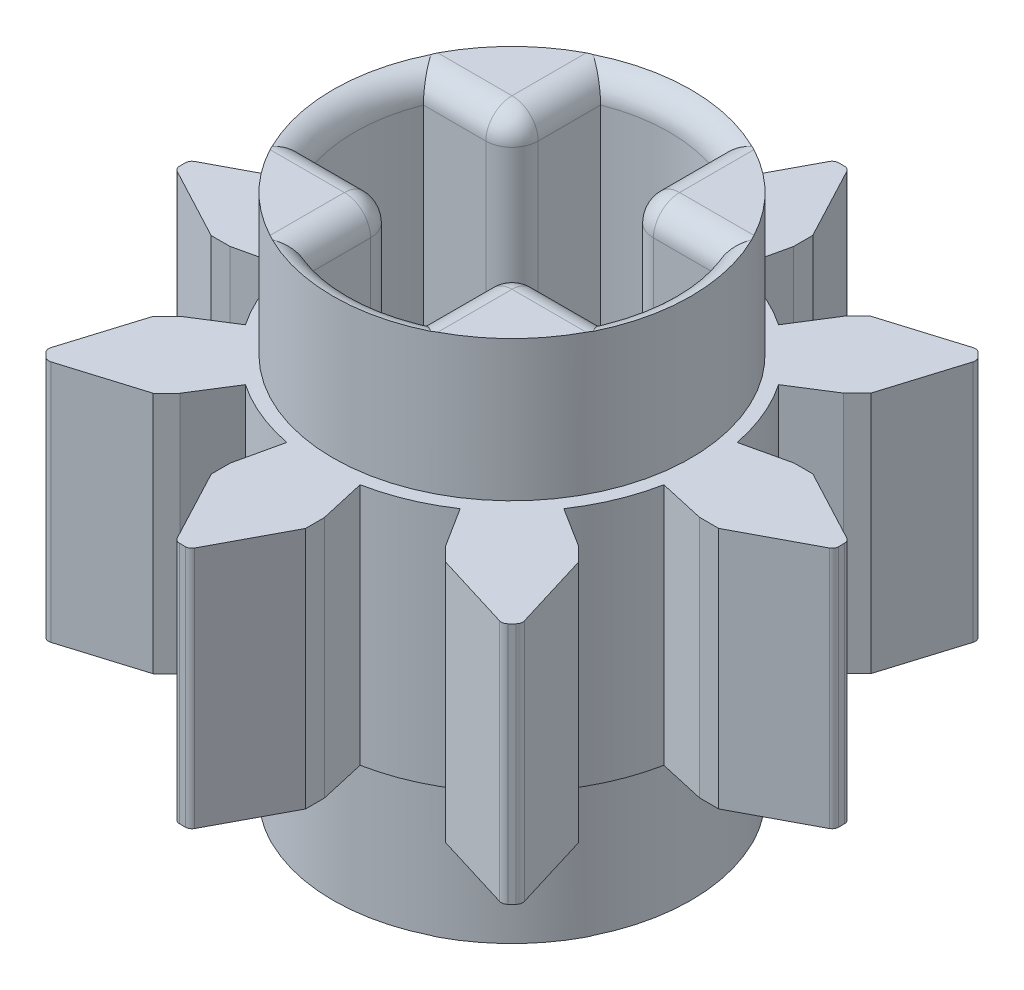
SolidWorks part; units mm, degrees
ref_plane "Front Plane" through (0, 0, 0) normal (0, 0, 1) x (1, 0, 0)
ref_plane "Top Plane" through (0, 0, 0) normal (0, 1, 0) x (1, 0, 0)
ref_plane "Right Plane" through (0, 0, 0) normal (1, 0, 0) x (0, 0, -1)
ref_plane "Plane1" through (0, 1.855, 0) normal (0, 1, 0) x (1, 0, 0)
sketch "Sketch1" plane through (0, 1.855, 0) normal (0, 1, 0) x (1, 0, 0)
  line L0 (-5.0277, -0.2195) -> (-3.8881, -0.862)
  line L1 (-3.8881, -0.862) -> (-2.8786, -0.5595)
  line L2 (-2.4312, -1.6398) -> (-3.3588, -2.1398)
  line L3 (-3.3588, -2.1398) -> (-3.7103, -3.3999)
  line L4 (-3.3999, -3.7103) -> (-2.1398, -3.3588)
  line L5 (-2.1398, -3.3588) -> (-1.6398, -2.4312)
  line L6 (-0.5595, -2.8786) -> (-0.862, -3.8881)
  line L7 (-0.862, -3.8881) -> (-0.2195, -5.0277)
  line L8 (0.2195, -5.0277) -> (0.862, -3.8881)
  line L9 (0.862, -3.8881) -> (0.5595, -2.8786)
  line L10 (1.6398, -2.4312) -> (2.1398, -3.3588)
  line L11 (2.1398, -3.3588) -> (3.3999, -3.7103)
  line L12 (3.7103, -3.3999) -> (3.3588, -2.1398)
  line L13 (3.3588, -2.1398) -> (2.4312, -1.6398)
  line L14 (2.8786, -0.5595) -> (3.8881, -0.862)
  line L15 (3.8881, -0.862) -> (5.0277, -0.2195)
  line L16 (5.0277, 0.2195) -> (3.8881, 0.862)
  line L17 (3.8881, 0.862) -> (2.8786, 0.5595)
  line L18 (2.4312, 1.6398) -> (3.3588, 2.1398)
  line L19 (3.3588, 2.1398) -> (3.7103, 3.3999)
  line L20 (3.3999, 3.7103) -> (2.1398, 3.3588)
  line L21 (2.1398, 3.3588) -> (1.6398, 2.4312)
  line L22 (0.5595, 2.8786) -> (0.862, 3.8881)
  line L23 (0.862, 3.8881) -> (0.2195, 5.0277)
  line L24 (-0.2195, 5.0277) -> (-0.862, 3.8881)
  line L25 (-0.862, 3.8881) -> (-0.5595, 2.8786)
  line L26 (-1.6398, 2.4312) -> (-2.1398, 3.3588)
  line L27 (-2.1398, 3.3588) -> (-3.3999, 3.7103)
  line L28 (-3.7103, 3.3999) -> (-3.3588, 2.1398)
  line L29 (-3.3588, 2.1398) -> (-2.4312, 1.6398)
  line L30 (-2.8786, 0.5595) -> (-3.8881, 0.862)
  line L31 (-3.8881, 0.862) -> (-5.0277, 0.2195)
  arc A0 (-5.0277, 0.2195) -> (-5.0277, -0.2195) centre (0, 0) ccw
  arc A1 (-2.8786, -0.5595) -> (-2.4312, -1.6398) centre (0, 0) ccw
  arc A2 (-3.7103, -3.3999) -> (-3.3999, -3.7103) centre (0, 0) ccw
  arc A3 (-1.6398, -2.4312) -> (-0.5595, -2.8786) centre (0, 0) ccw
  arc A4 (-0.2195, -5.0277) -> (0.2195, -5.0277) centre (0, 0) ccw
  arc A5 (0.5595, -2.8786) -> (1.6398, -2.4312) centre (0, 0) ccw
  arc A6 (3.3999, -3.7103) -> (3.7103, -3.3999) centre (0, 0) ccw
  arc A7 (2.4312, -1.6398) -> (2.8786, -0.5595) centre (0, 0) ccw
  arc A8 (5.0277, -0.2195) -> (5.0277, 0.2195) centre (0, 0) ccw
  arc A9 (2.8786, 0.5595) -> (2.4312, 1.6398) centre (0, 0) ccw
  arc A10 (3.7103, 3.3999) -> (3.3999, 3.7103) centre (0, 0) ccw
  arc A11 (1.6398, 2.4312) -> (0.5595, 2.8786) centre (0, 0) ccw
  arc A12 (0.2195, 5.0277) -> (-0.2195, 5.0277) centre (0, 0) ccw
  arc A13 (-0.5595, 2.8786) -> (-1.6398, 2.4312) centre (0, 0) ccw
  arc A14 (-3.3999, 3.7103) -> (-3.7103, 3.3999) centre (0, 0) ccw
  arc A15 (-2.4312, 1.6398) -> (-2.8786, 0.5595) centre (0, 0) ccw
extrude "Boss-Extrude1" add sketch "Sketch1" against normal blind 3.71
sketch "Sketch2" plane through (0, 1.855, 0) normal (0, 1, 0) x (-1, 0, 0)
  circle A0 centre (0, 0) radius 2.7325
extrude "Boss-Extrude2" add sketch "Sketch2" along normal blind 2.1775
sketch "Sketch3" plane through (0, -1.855, 0) normal (0, -1, 0) x (1, 0, 0)
  circle A0 centre (0, 0) radius 2.7325
extrude "Boss-Extrude3" add sketch "Sketch3" along normal blind 2.1775
hole_wizard "M4 Clearance Hole1" positions "Sketch5" profile "Sketch4" hole size "M4" standard "ANSI Metric"
sketch "Sketch5" plane through (0, -4.0325, 0) normal (0, -1, 0) x (-1, 0, 0)
  point P0 (0, 0)
sketch "Sketch4" plane through (0, -4.0325, 0) normal (1, 0, 0) x (0, 0, -1)
  line L0 (0, 0) -> (0, 8.065)
  line L1 (0, 8.065) -> (2.39, 8.065)
  line L2 (2.39, 8.065) -> (2.39, 0)
  line L5 (2.39, 0) -> (0, 0)
  line L11 (0, -6.35) -> (0, 107.95) construction
  dimension "Thru Hole Dia." = 4.78
  dimension "Thru Hole Depth" = 8.065
ref_plane "Plane2" through (0, -3.9, 0) normal (0, -1, 0) x (1, 0, 0)
sketch "Sketch6" plane through (0, -3.9, 0) normal (0, -1, 0) x (1, 0, 0)
  line L0 (0.875, 2.2241) -> (0.875, 0.875)
  line L1 (0.875, 0.875) -> (2.2241, 0.875)
  arc A0 (2.2241, 0.875) -> (0.875, 2.2241) centre (0, 0) ccw
extrude "Boss-Extrude4" add sketch "Sketch6" against normal blind 7.8
ref_plane "Plane3" through (0, 3.9, 0) normal (0, 1, 0) x (1, 0, 0)
sketch "Sketch7" plane through (0, 3.9, 0) normal (0, 1, 0) x (1, 0, 0)
  line L0 (-0.875, -0.875) -> (-2.2241, -0.875)
  line L1 (-0.875, -2.2241) -> (-0.875, -0.875)
  arc A0 (-2.2241, -0.875) -> (-0.875, -2.2241) centre (0, 0) ccw
extrude "Boss-Extrude5" add sketch "Sketch7" against normal blind 7.8
sketch "Sketch8" plane through (0, -3.9, 0) normal (0, -1, 0) x (1, 0, 0)
  line L0 (2.2241, -0.875) -> (0.875, -0.875)
  line L1 (0.875, -0.875) -> (0.875, -2.2241)
  arc A0 (0.875, -2.2241) -> (2.2241, -0.875) centre (0, 0) ccw
extrude "Boss-Extrude6" add sketch "Sketch8" against normal blind 7.8
sketch "Sketch9" plane through (0, 3.9, 0) normal (0, 1, 0) x (1, 0, 0)
  line L0 (-0.875, 0.875) -> (-0.875, 2.2241)
  line L1 (-2.2241, 0.875) -> (-0.875, 0.875)
  arc A0 (-0.875, 2.2241) -> (-2.2241, 0.875) centre (0, 0) ccw
extrude "Boss-Extrude7" add sketch "Sketch9" against normal blind 7.8
fillet "Fillet1" radius 0.5 4 edges at (0.875, 0, -0.875) (-0.875, 0, 0.875) (0.875, 0, 0.875) (-0.875, 0, -0.875)
fillet "Fillet2" radius 0.2 28 edges at (-0.875, 3.9, 1.7995) (-1.7995, 3.9, 0.875) (-1.0214, 3.9, 1.0214) (-5.0277, 0, 0.2195) (-3.3999, 0, -3.7103) (1.7995, 3.9, 0.875) (0.875, 3.9, 1.7995) (1.0214, 3.9, 1.0214) (-1.7995, 3.9, -0.875) (-1.0214, 3.9, -1.0214) (-0.875, 3.9, -1.7995) (5.0277, 0, 0.2195) (0.875, 3.9, -1.7995) (1.0214, 3.9, -1.0214) (1.7995, 3.9, -0.875) (-3.3999, 0, 3.7103) (3.7103, 0, -3.3999) (3.3999, 0, -3.7103) (-0.2195, 0, 5.0277) (3.3999, 0, 3.7103) (-3.7103, 0, 3.3999) (0.2195, 0, -5.0277) (3.7103, 0, 3.3999) (-5.0277, 0, -0.2195) (0.2195, 0, 5.0277) (-0.2195, 0, -5.0277) (5.0277, 0, -0.2195) (-3.7103, 0, -3.3999)
fillet "Fillet3" radius 0.75 16 edges at (-3.8881, 0, 0.862) (-2.1398, 0, -3.3588) (-0.862, 0, -3.8881) (3.8881, 0, -0.862) (-3.3588, 0, 2.1398) (3.8881, 0, 0.862) (0.862, 0, 3.8881) (3.3588, 0, -2.1398) (-0.862, 0, 3.8881) (3.3588, 0, 2.1398) (-3.3588, 0, -2.1398) (2.1398, 0, -3.3588) (-3.8881, 0, -0.862) (2.1398, 0, 3.3588) (0.862, 0, -3.8881) (-2.1398, 0, 3.3588)
sketch "Sketch10" plane through (0, 4.0325, 0) normal (0, 1, 0) x (-1, 0, 0)
  circle A0 centre (0, 0) radius 2.7325
extrude "Boss-Extrude8" add sketch "Sketch10" against normal up to surface (8.065 mm away)
sketch "Sketch11" plane through (0, 4.0325, 0) normal (0, 1, 0) x (-1, 0, 0)
  circle A0 centre (0, 0) radius 2.7325
extrude "Cut-Extrude1" cut sketch "Sketch11" against normal blind 0.0325
mirror "Mirror1" about plane through (0, 0, 0) normal (0, 1, 0) of "Cut-Extrude1"
sketch "Sketch12" plane through (0, 4, 0) normal (0, 1, 0) x (-1, 0, 0)
  line L0 (0.88, -2.2328) -> (0.88, -1.28)
  line L1 (-0.88, 2.2328) -> (-0.88, 1.28)
  line L2 (-2.2328, -0.88) -> (-1.28, -0.88)
  line L3 (2.2328, 0.88) -> (1.28, 0.88)
  line L4 (1.28, -0.88) -> (2.2328, -0.88)
  line L5 (0.88, 1.28) -> (0.88, 2.2328)
  line L6 (-0.88, -1.28) -> (-0.88, -2.2328)
  line L7 (-1.28, 0.88) -> (-2.2328, 0.88)
  arc A0 (-0.88, -2.2328) -> (0.88, -2.2328) centre (0, 0) ccw
  arc A1 (-2.2328, 0.88) -> (-2.2328, -0.88) centre (0, 0) ccw
  arc A2 (0.88, 2.2328) -> (-0.88, 2.2328) centre (0, 0) ccw
  arc A3 (2.2328, -0.88) -> (2.2328, 0.88) centre (0, 0) ccw
  arc A4 (0.88, 1.28) -> (1.28, 0.88) centre (1.28, 1.28) ccw
  arc A5 (-0.88, 1.28) -> (-1.28, 0.88) centre (-1.28, 1.28) cw
  arc A6 (-1.28, -0.88) -> (-0.88, -1.28) centre (-1.28, -1.28) cw
  arc A7 (1.28, -0.88) -> (0.88, -1.28) centre (1.28, -1.28) ccw
extrude "Cut-Extrude2" cut sketch "Sketch12" against normal through all
fillet "Fillet4" radius 0.4 16 edges at (-0.9972, -4, -0.9972) (-0.9972, -4, 0.9972) (0.9972, -4, 0.9972) (0.9972, -4, -0.9972) (0, -4, -2.4) (-0.88, -4, -1.7564) (-1.7564, -4, -0.88) (-2.4, -4, 0) (-1.7564, -4, 0.88) (-0.88, -4, 1.7564) (0, -4, 2.4) (0.88, -4, 1.7564) (1.7564, -4, 0.88) (2.4, -4, 0) (1.7564, -4, -0.88) (0.88, -4, -1.7564)
fillet "Fillet5" radius 0.4 16 edges at (0.88, 4, 1.7564) (-2.4, 4, 0) (-1.7564, 4, 0.88) (-0.9972, 4, 0.9972) (-0.88, 4, 1.7564) (0, 4, 2.4) (0.9972, 4, 0.9972) (1.7564, 4, 0.88) (2.4, 4, 0) (1.7564, 4, -0.88) (0.9972, 4, -0.9972) (0.88, 4, -1.7564) (0, 4, -2.4) (-0.88, 4, -1.7564) (-0.9972, 4, -0.9972) (-1.7564, 4, -0.88)
sketch "Sketch17" plane through (0, 1.855, 0) normal (0, 1, 0) x (1, 0, 0)
  line L0 (-0.7206, 3.8735) -> (-0.1329, 4.9784)
  line L1 (-0.5595, 2.8786) -> (-0.7206, 3.5868)
  line L2 (-0.7206, 3.5868) -> (-0.7206, 3.8735)
  line L3 (-0.0446, 5.0314) -> (0.0445, 5.0314)
  line L4 (0.1329, 4.9782) -> (0.7178, 3.8746)
  line L5 (0.7178, 3.8746) -> (0.7178, 3.5811)
  line L6 (0.7178, 3.5811) -> (0.5595, 2.8786)
  line L7 (-0.5595, 2.8786) -> (-1.2784, 4.5764)
  line L8 (-1.2784, 4.5764) -> (0.0445, 5.5647)
  line L9 (0.0445, 5.5647) -> (1.1543, 4.5764)
  line L10 (1.1543, 4.5764) -> (0.5595, 2.8786)
  arc A0 (0.0445, 5.0314) -> (0.1329, 4.9782) centre (0.0445, 4.9314) cw
  arc A1 (-0.1329, 4.9784) -> (-0.0446, 5.0314) centre (-0.0446, 4.9314) cw
extrude "Cut-Extrude3" cut sketch "Sketch17" against normal through all
pattern_circular "CirPattern1" count 8 every 45 about axis through (0, 0, 0) along (0, 1, 0) of "Cut-Extrude3"
